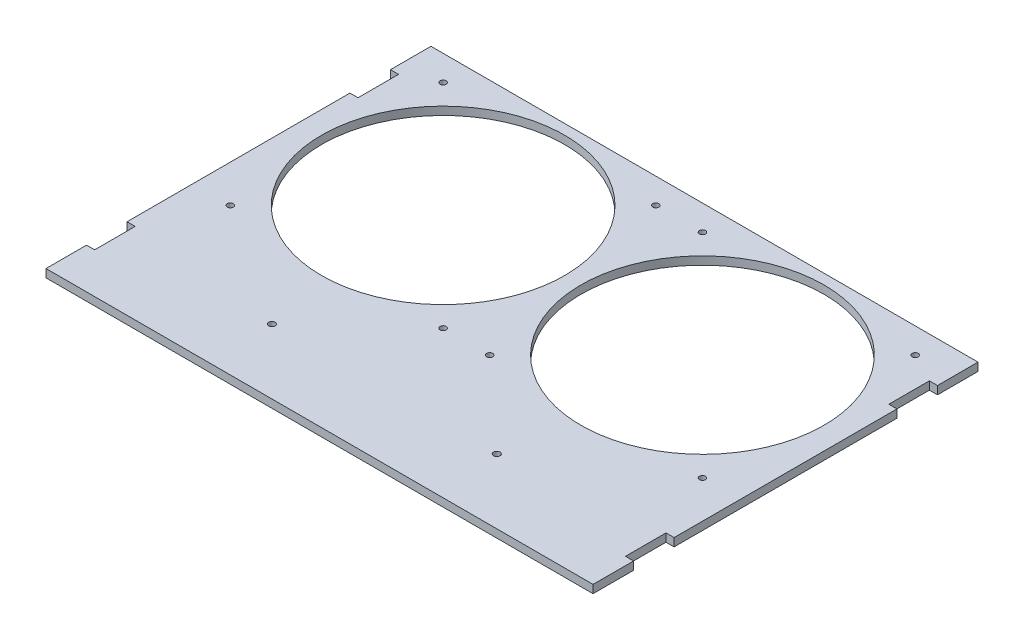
SolidWorks part; units mm, degrees
ref_plane "Ebene vorne" through (0, 0, 0) normal (0, 0, 1) x (1, 0, 0)
ref_plane "Ebene oben" through (0, 0, 0) normal (0, 1, 0) x (1, 0, 0)
ref_plane "Ebene rechts" through (0, 0, 0) normal (1, 0, 0) x (0, 0, -1)
sketch "Skizze1" plane through (0, 0, 0) normal (0, 1, 0) x (1, 0, 0)
  line L0 (0, 66.3504) -> (0, -137.1838) construction
  line L1 (-139.5773, 0) -> (144.78, 0) construction
  line L2 (-64, 65) -> (-64, -125) construction
  line L3 (-135, 65) -> (135, 65)
  line L4 (-135, 65) -> (-135, 45)
  line L5 (-135, -125) -> (135, -125)
  line L6 (135, 65) -> (135, 45)
  line L7 (64, 65) -> (64, -125) construction
  line L8 (-135, 25) -> (-135, -85)
  line L9 (-135, 45) -> (-131, 45)
  line L10 (-135, -105) -> (-135, -125)
  line L11 (-135, 25) -> (-131, 25)
  line L12 (-131, 45) -> (-131, 25)
  line L13 (-135, -85) -> (-131, -85)
  line L14 (135, 45) -> (131, 45)
  line L15 (-135, -105) -> (-131, -105)
  line L16 (-131, -85) -> (-131, -105)
  line L17 (131, 45) -> (131, 25)
  line L18 (135, 25) -> (131, 25)
  line L19 (131, -85) -> (131, -105)
  line L20 (135, -105) -> (131, -105)
  line L21 (135, -85) -> (131, -85)
  line L22 (135, 25) -> (135, -85)
  line L23 (135, -105) -> (135, -125)
  line L24 (-70.5508, -93) -> (15.6725, -93) construction
  circle A0 centre (-64, 0) radius 60
  circle A1 centre (-116.5, 52.5) radius 1.5
  circle A2 centre (-11.5, 52.5) radius 1.5
  circle A3 centre (-116.5, -52.5) radius 1.5
  circle A4 centre (-11.5, -52.5) radius 1.5
  circle A5 centre (116.5, -52.5) radius 1.5
  circle A6 centre (11.5, -52.5) radius 1.5
  circle A7 centre (11.5, 52.5) radius 1.5
  circle A8 centre (116.5, 52.5) radius 1.5
  circle A9 centre (64, 0) radius 60
  circle A10 centre (-55.5, -93) radius 1.6
  circle A11 centre (55.5, -93) radius 1.6
  dimension "D3" = 120
  dimension "D4" = 3
  dimension "D14" = 3.2
  dimension "D1" = 270
  dimension "D2" = 190
  dimension "D5" = 105
  dimension "D6" = 128
  dimension "D7" = 105
  dimension "D8" = 65
  dimension "D9" = 4
  dimension "D10" = 20
  dimension "D11" = 20
  dimension "D12" = 20
  dimension "D13" = 20
  dimension "D15" = 111
  dimension "D16" = 32
extrude "Aufsatz-Linear austragen1" add sketch "Skizze1" along normal blind 4
